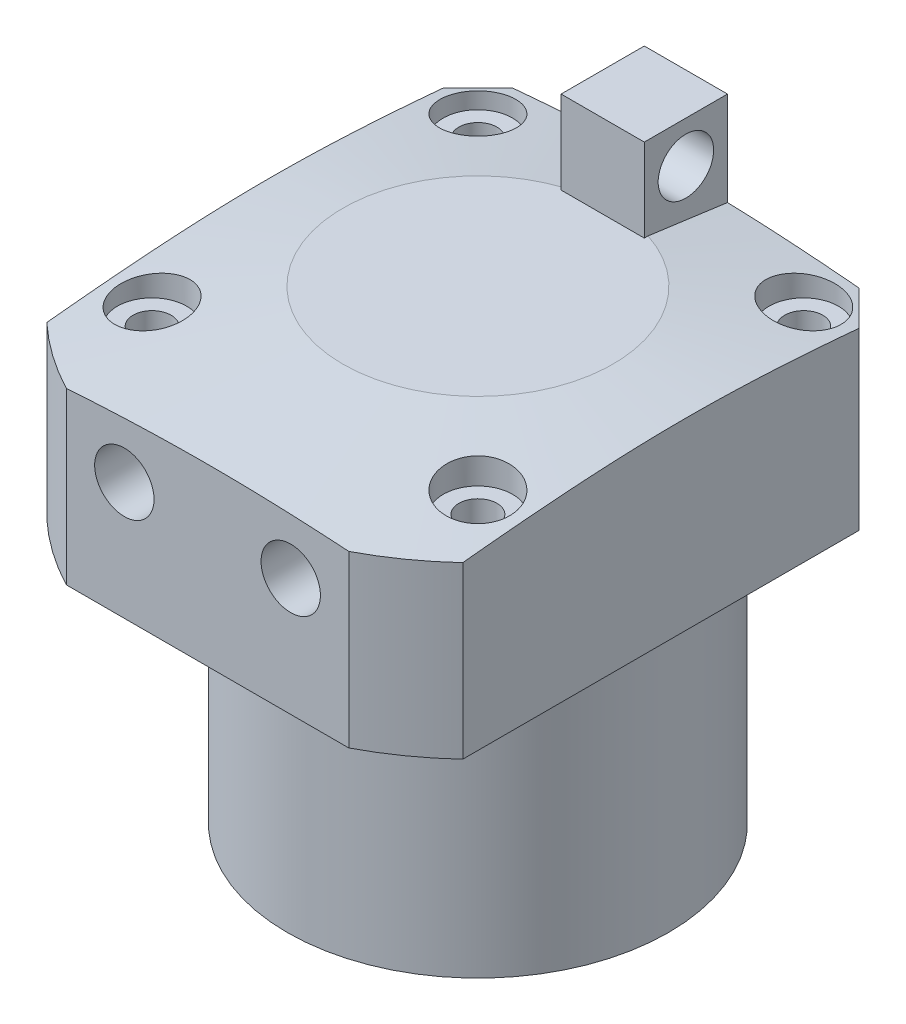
SolidWorks part; units mm, degrees
ref_plane "Front Plane" through (0, 0, 0) normal (0, 0, 1) x (1, 0, 0)
ref_plane "Top Plane" through (0, 0, 0) normal (0, 1, 0) x (1, 0, 0)
ref_plane "Right Plane" through (0, 0, 0) normal (1, 0, 0) x (0, 0, -1)
sketch "Sketch1" plane through (0, 0, 0) normal (0, 0, 1) x (1, 0, 0)
  line L0 (0, 87.0508) -> (0, 0) construction
  line L1 (0, 0) -> (-27.5, 0)
  line L2 (-27.5, 0) -> (-27.5, 39)
  line L3 (-27.5, 39) -> (-44, 39)
  line L4 (-44, 39) -> (-44, 63.555)
  line L5 (-19.4875, 67) -> (-44, 63.555)
  line L6 (-19.4875, 67) -> (0, 67)
  line L7 (0, 0) -> (0, 67)
  dimension "D1" = 27.5
  dimension "D2" = 39
  dimension "D3" = 44
  dimension "D4" = 8
  dimension "D5" = 28
revolve "Revolve1" add sketch "Sketch1" angle 360 about L0
sketch "Sketch2" plane through (0, 67, 0) normal (0, 1, 0) x (1, 0, 0)
  line L0 (0, 0) -> (0, 30) construction
  line L1 (-30, 30) -> (30, 30)
  line L2 (-30, 30) -> (-30, -39)
  line L3 (-30, -39) -> (30, -39)
  line L4 (30, 30) -> (30, -39)
  dimension "D1" = 69
  dimension "D2" = 60
  dimension "D3" = 30
extrude "Cut-Extrude2" cut sketch "Sketch2" against normal through all flip side to cut
chamfer "Chamfer1" distance 5 angle 45 2 edges at (30, 51.3881, -30) (-30, 51.3881, -30)
hole_wizard "G1/8 Tapped Hole1" positions "Sketch6" profile "Sketch5" tap size "G1/8" standard "ISO"
sketch "Sketch6" plane through (0, 0, 39) normal (0, 0, 1) x (1, 0, 0)
  line L0 (-12, 56) -> (12, 56) construction
  line L4 (0, 56) -> (0, 67) construction
  line L5 (-20.3715, 67) -> (20.3715, 67) construction
  point P0 (-12, 56)
  point P1 (12, 56)
  dimension "D1" = 11
  dimension "D2" = 24
sketch "Sketch5" plane through (-12, 56, 39) normal (1, 0, 0) x (0, -1, 0)
  line L0 (0, 0) -> (0, 22.18)
  line L1 (0, 22.18) -> (4.283, 22.18)
  line L2 (4.283, 22.18) -> (4.283, 0)
  line L5 (4.283, 0) -> (0, 0)
  line L10 (0, 22.18) -> (-4.283, 22.18) construction
  line L11 (0, -6.35) -> (0, 107.95) construction
  dimension "Tap Drill Dia." = 8.566
  dimension "Tap Drill Depth" = 22.18
  dimension "Drill Angle" = 180
hole_wizard "Ø8.0 (8) Diameter Hole2" positions "Sketch10" profile "Sketch9" hole size "Ø8.0" standard "ISO"
sketch "Sketch10" plane through (0, 39, 0) normal (0, -1, 0) x (1, 0, 0)
  point P0 (-12, 33.5)
  point P1 (12, 33.5)
  dimension "D1" = 33.5
  dimension "D2" = 12
  dimension "D3" = 12
sketch "Sketch9" plane through (-12, 39, 33.5) normal (1, 0, 0) x (0, 0, -1)
  line L0 (0, 0) -> (0, 1.5)
  line L1 (0, 1.5) -> (4, 1.5)
  line L2 (4, 1.5) -> (4, 0)
  line L5 (4, 0) -> (0, 0)
  line L10 (0, 1.5) -> (-4, 1.5) construction
  line L11 (0, -6.35) -> (0, 107.95) construction
  dimension "Hole Dia." = 8
  dimension "Hole Depth" = 1.5
  dimension "Drill Angle" = 180
hole_wizard "CBORE for M5 Hex Socket Head Cap Screw2" positions "Sketch12" profile "Sketch11" counterbore size "M5" standard "ISO"
sketch "Sketch12" plane through (0, 67, 0) normal (0, 1, 0) x (-1, 0, 0)
  point P0 (23.5, 23.5)
  point P1 (23.5, -23.5)
  point P4 (-23.5, -23.5)
  point P7 (-23.5, 23.5)
  dimension "D1" = 47
  dimension "D2" = 47
sketch "Sketch11" plane through (-23.5, 67, 23.5) normal (1, 0, 0) x (0, 0, 1)
  line L0 (0, 0) -> (0, 28)
  line L1 (2.75, 27.975) -> (2.775, 28)
  line L2 (2.75, 27.975) -> (2.75, 5)
  line L3 (2.75, 5) -> (5, 5)
  line L4 (5, 5) -> (5, 0)
  line L5 (5, 0) -> (0, 0)
  line L11 (0, -6.35) -> (0, 107.95) construction
  line L12 (2.775, 28) -> (0, 28)
  line L13 (-2.75, 27.975) -> (-2.775, 28) construction
  dimension "Thru Hole Dia." = 5.5
  dimension "Thru Hole Depth" = 28
  dimension "C'Bore Dia." = 10
  dimension "C'Bore Depth" = 5
  dimension "Far C'Sink Dia." = 5.55
  dimension "Far C'Sink Angle" = 90
sketch "Sketch13" plane through (0, 67, 0) normal (0, 1, 0) x (1, 0, 0)
  line L0 (25, 30) -> (-25, 30) construction
  line L1 (-6, 18) -> (6, 18)
  line L2 (-6, 18) -> (-6, 30)
  line L3 (-6, 30) -> (6, 30)
  line L4 (6, 18) -> (6, 30)
  line L5 (-6, 18) -> (6, 30) construction
  line L6 (-6, 30) -> (6, 18) construction
  point P0 (0, 24)
  dimension "D1" = 12
  dimension "D2" = 12
extrude "Boss-Extrude1" add sketch "Sketch13" along normal blind 12 and the other way up to surface
sketch "Sketch14" plane through (6, 0, 0) normal (1, 0, 0) x (0, 0, -1)
  line L0 (18, 79) -> (30, 79) construction
  line L1 (18, 79) -> (18, 67) construction
  circle A0 centre (24, 73) radius 4
  dimension "D1" = 8
  dimension "D2" = 6
  dimension "D3" = 6
extrude "Cut-Extrude3" cut sketch "Sketch14" against normal blind 15
